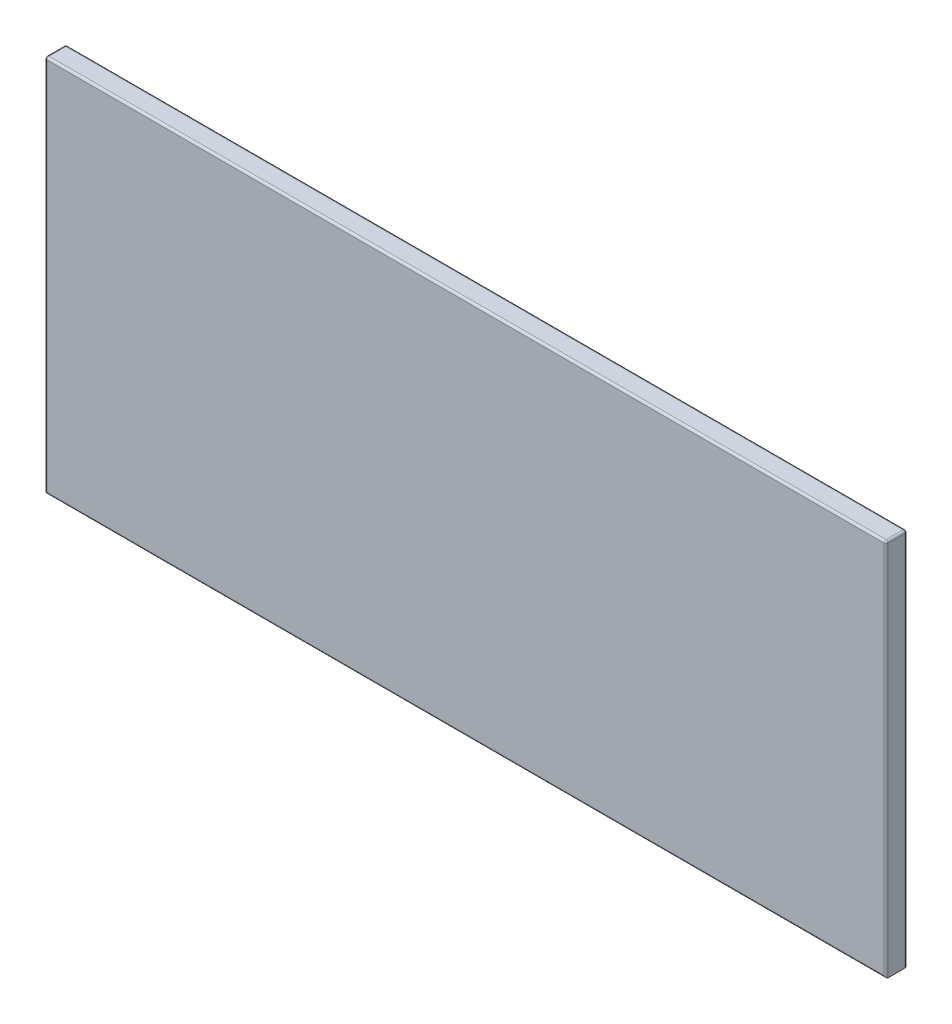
SolidWorks part; units mm, degrees
ref_plane "Front Plane" through (0, 0, 0) normal (0, 0, 1) x (1, 0, 0)
ref_plane "Top Plane" through (0, 0, 0) normal (0, 1, 0) x (1, 0, 0)
ref_plane "Right Plane" through (0, 0, 0) normal (1, 0, 0) x (0, 0, -1)
sketch "Sketch1" plane through (0, 0, 0) normal (0, 0, 1) x (1, 0, 0)
  line L1 (-464.6553, -37.0453) -> (551.3447, -37.0453)
  line L2 (-464.6553, -37.0453) -> (-464.6553, 420.1547)
  line L3 (-464.6553, 420.1547) -> (551.3447, 420.1547)
  line L4 (551.3447, -37.0453) -> (551.3447, 420.1547)
  dimension "D1" = 1016
  dimension "D2" = 457.2
extrude "Boss-Extrude1" add sketch "Sketch1" along normal blind 25.4
fillet "Fillet1" radius 2.54 10 edges at (43.3447, -37.0453, 0) (551.3447, 191.5547, 0) (-464.6553, 191.5547, 0) (551.3447, 191.5547, 25.4) (43.3447, -37.0453, 25.4) (-464.6553, 191.5547, 25.4) (551.3447, 420.1547, 12.7) (43.3447, 420.1547, 25.4) (-464.6553, 420.1547, 12.7) (43.3447, 420.1547, 0)
